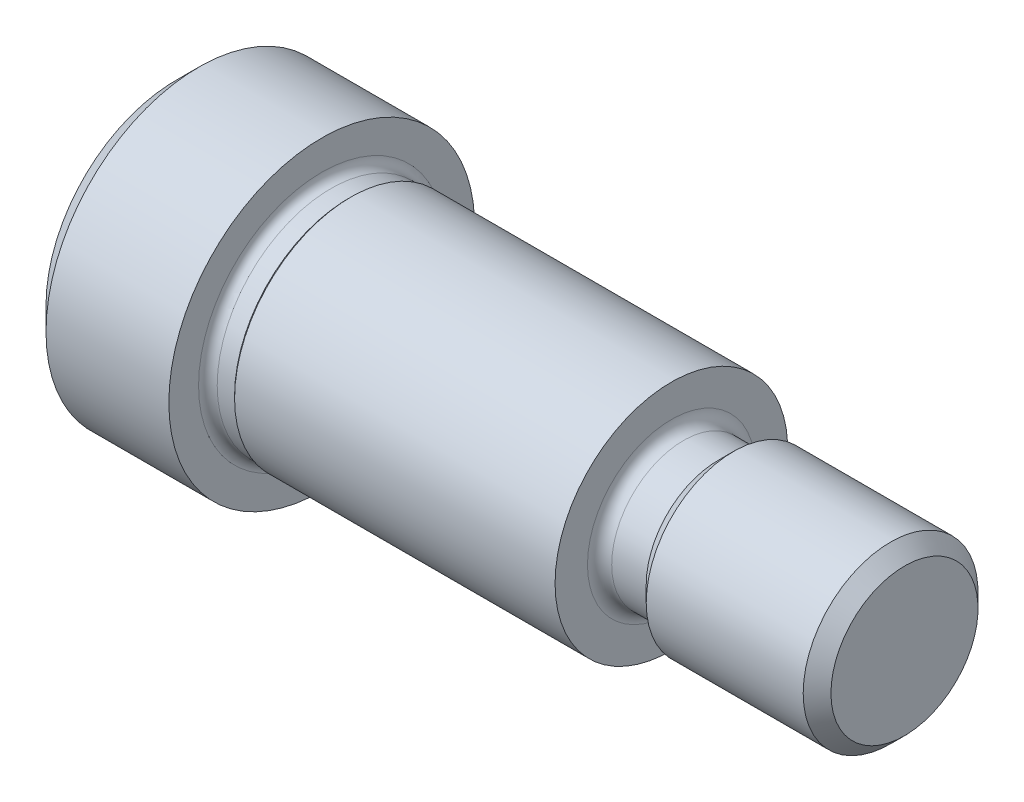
SolidWorks part; units mm, degrees
ref_plane "Plane1" through (0, 0, 0) normal (0, 0, 1) x (1, 0, 0)
ref_plane "Plane2" through (0, 0, 0) normal (0, 1, 0) x (1, 0, 0)
ref_plane "Plane3" through (0, 0, 0) normal (1, 0, 0) x (0, 0, -1)
sketch "BodySke" plane through (0, 0, 0) normal (0, 0, 1) x (1, 0, 0)
  line L0 (0, 0) -> (0, 14.1732)
  line L1 (0, 14.1732) -> (2.4892, 16.6624)
  line L2 (2.4892, 16.6624) -> (15.875, 16.6624)
  line L3 (15.875, 16.6624) -> (15.875, 13.4239)
  line L4 (16.891, 12.4079) -> (18.7833, 12.4079)
  line L5 (18.7833, 12.4079) -> (19.05, 12.6746)
  line L6 (19.05, 12.6746) -> (53.975, 12.6746)
  line L7 (53.975, 12.6746) -> (53.975, 9.144)
  line L8 (55.2958, 7.8232) -> (59.055, 7.8232)
  line L9 (59.055, 7.8232) -> (60.7568, 9.525)
  line L10 (60.7568, 9.525) -> (77.8624, 9.525)
  line L11 (77.8624, 9.525) -> (79.375, 8.0124)
  line L12 (79.375, 8.0124) -> (79.375, 0)
  line L13 (79.375, 0) -> (0, 0)
  line L14 (-6.35, 0) -> (107.95, 0) construction
  line L15 (77.8624, -9.525) -> (79.375, -8.0124) construction
  line L16 (53.975, -7.8232) -> (59.055, -7.8232) construction
  line L17 (19.05, -12.6746) -> (53.975, -12.6746) construction
  line L18 (15.875, -12.4079) -> (18.7833, -12.4079) construction
  line L19 (2.4892, -16.6624) -> (15.875, -16.6624) construction
  line L20 (61.595, 12.6746) -> (61.595, -4.6782) construction
  line L21 (56.515, 12.6746) -> (56.515, -3.175) construction
  arc A0 (53.975, 9.144) -> (55.2958, 7.8232) centre (55.2958, 9.144) ccw
  arc A1 (16.891, 12.4079) -> (15.875, 13.4239) centre (16.891, 13.4239) cw
  point P29 (53.975, 7.8232)
  point P32 (15.875, 12.4079)
  dimension "Thread_neck_fillet_rad" = 1.3208
  dimension "Head_fillet_radius" = 1.016
  dimension "Head_dia" = 33.3248
  dimension "Head_ht" = 15.875
  dimension "Head_side_ht" = 13.3858
  dimension "Head_ch_ang" = 45
  dimension "Shoulder_neck_dia" = 24.8158
  dimension "Diameter" = 25.3492
  dimension "Thread_dia" = 19.05
  dimension "Minor_dia" = 16.0249
  dimension "Thread_ch_ang" = 45
  dimension "Thread_neck_dia" = 15.6464
  dimension "D11" = 45
  dimension "Thread_length" = 25.4
  dimension "D13" = 45
  dimension "Length" = 38.1
  dimension "Thread_neck_width" = 5.08
  dimension "Shoulder_neck_width" = 3.175
  dimension "Advance" = 2.54
  dimension "Thread_nom" = 22.86
  dimension "Thread_lim" = 17.78
revolve "BaseBody" add sketch "BodySke"
pattern_linear "ThdSchPat" [suppressed]
revolve "ThreadSchematic" cut sketch "ThdSchSke" angle 360 about L14
sketch "ThdSchSke" plane through (0, 0, 0) normal (0, 0, 1) x (1, 0, 0)
  line L0 (61.595, -8.0124) -> (58.3305, -12.6746)
  line L1 (61.595, -8.0124) -> (64.8595, -12.6746)
  line L2 (64.8595, -12.6746) -> (64.8595, -15.8432)
  line L3 (-3.175, 0) -> (5.1513, 0) construction
  line L4 (0, 14.1732) -> (0, -14.1732) construction
  line L5 (64.8595, -15.8432) -> (58.3305, -15.8432)
  line L6 (58.3305, -15.8432) -> (58.3305, -12.6746)
  dimension "D1" = 360
  dimension "Thread_minor" = 16.0249
  dimension "D2" = 1
  dimension "Diameter" = 25.3492
  dimension "Start" = 61.595
  dimension "D4" = 50
  dimension "SideAngle" = 55
  dimension "VeeAngle" = 70
  dimension "Overcut" = 31.6865
  dimension "Num_threads" = 7
  dimension "Advance" = 2.54
  dimension "Thread_length" = 17.78
sketch "Sketch2" plane through (0, 0, 0) normal (0, 0, 1) x (1, 0, 0)
  line L0 (0, 6.35) -> (9.525, 6.35)
  line L1 (9.525, 6.35) -> (13.1912, 0)
  line L2 (0, 14.1732) -> (0, -14.1732) construction
  line L3 (13.1912, 0) -> (0, 0)
  line L4 (0, 0) -> (0, 6.35)
  line L5 (0, -6.35) -> (9.525, -6.35) construction
  line L6 (0, 0) -> (47.625, 0) construction
  dimension "D2" = 60
  dimension "PreBroach_depth" = 9.525
  dimension "PreBroach_dia" = 12.7
revolve "PreBroach" cut sketch "Sketch2" angle 360 about L6
sketch "Sketch3" plane through (0, 0, 0) normal (-1, 0, 0) x (0, 0, 1)
  line L0 (-6.35, -3.6662) -> (-6.35, 3.6662)
  line L1 (-6.35, 3.6662) -> (0, 7.3323)
  line L2 (0, 7.3323) -> (6.35, 3.6662)
  line L3 (6.35, 3.6662) -> (6.35, -3.6662)
  line L4 (6.35, -3.6662) -> (0, -7.3323)
  line L5 (0, -7.3323) -> (-6.35, -3.6662)
  dimension "D1" = 6.35
  dimension "Hex_size" = 12.7
  dimension "D2" = 6.35
  dimension "D3" = 120
  dimension "D4" = 12.7
extrude "Hex" cut sketch "Sketch3" against normal blind 9.525
equation "\"Thread_minor@ThreadCosmetic\" = \"Minor_dia@BodySke\""
equation "\"D1@Sketch3\" = \"Hex_size@Sketch3\" / 2"
equation "\"D2@Sketch3\" = \"D1@Sketch3\""
equation "\"D4@Sketch3\" = \"Hex_size@Sketch3\""
equation "\"Thread_length@ThreadCosmetic\" = ((sgn( (\"Thread_length@BodySke\" - \"Advance@BodySke\" - \"Thread_neck_width@BodySke\" ) - \"Thread_nom@BodySke\" )-1)*( (\"Thread_length@BodySke\" - \"Advance@BodySke\" - \"Threa"
equation "\"Thread_minor@ThdSchSke\" = \"Minor_dia@BodySke\""
equation "\"Diameter@ThdSchSke\" = \"Diameter@BodySke\""
equation "\"Overcut@ThdSchSke\" = \"Diameter@BodySke\" * 1.25"
equation "\"Start@ThdSchSke\" = \"Head_ht@BodySke\" + \"Length@BodySke\" + \"Thread_length@BodySke\" -  \"Thread_length@ThreadCosmetic\"  '---Non-countersunk---"
equation "\"Num_threads@ThdSchPat\" = int( \"Thread_length@ThreadCosmetic\" / \"Advance@BodySke\" + 0.999 ) + 1"
equation "\"Advance@ThdSchPat\" = \"Thread_length@ThreadCosmetic\" /  (\"Num_threads@ThdSchPat\" - 1) 'relax it"
equation "\"Num_threads@ThdSchPat\" = \"Num_threads@ThdSchPat\" - sgn( \"Num_threads@ThdSchPat\" - 1) '---chamfered tips only---"
